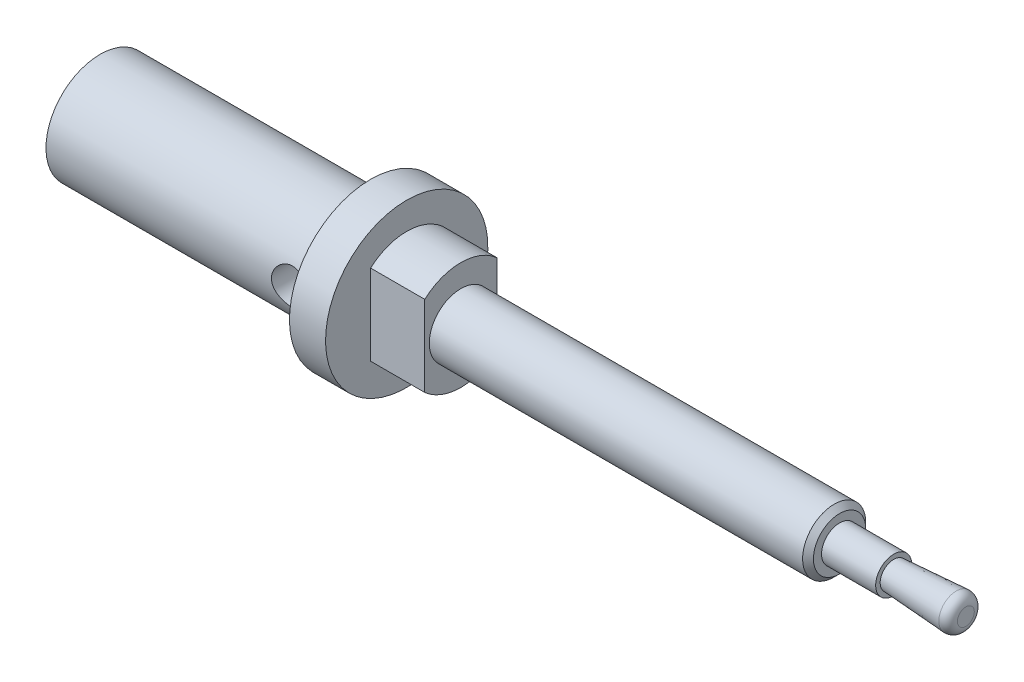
SolidWorks part; units mm, degrees
ref_plane "Plan de face" through (0, 0, 0) normal (0, 0, 1) x (1, 0, 0)
ref_plane "Plan de dessus" through (0, 0, 0) normal (0, 1, 0) x (1, 0, 0)
ref_plane "Plan de droite" through (0, 0, 0) normal (1, 0, 0) x (0, 0, -1)
sketch "Esquisse1" plane through (0, 0, 0) normal (0, 0, 1) x (1, 0, 0)
  line L0 (-15, 0) -> (-15, 3)
  line L1 (-15, 3) -> (0, 3)
  line L2 (0, 3) -> (0, 4.5)
  line L3 (0, 4.5) -> (2, 4.5)
  line L4 (2, 4.5) -> (2, 3)
  line L5 (2, 3) -> (5, 3)
  line L6 (5, 3) -> (5, 1.75)
  line L7 (5, 1.75) -> (26, 1.75)
  line L8 (26, 1.75) -> (26, 1)
  line L9 (26, 1) -> (29, 1)
  line L10 (29, 1) -> (29, 0.75)
  line L11 (33, 1) -> (33, 0)
  line L12 (33, 0) -> (-15, 0)
  line L13 (29, 0.75) -> (33, 1)
  dimension "D1" = 2
  dimension "D2" = 15
  dimension "D3" = 3
  dimension "D4" = 21
  dimension "D5" = 3
  dimension "D6" = 4
  dimension "D7" = 1
  dimension "D8" = 1.75
  dimension "D9" = 1
  dimension "D10" = 3
  dimension "D11" = 3
  dimension "D12" = 4.5
  dimension "D13" = 0.25
revolve "Révolution1" add sketch "Esquisse1" angle 360 about L12
fillet "Congé1" radius 0.5 1 edges at (33, 1, 0)
chamfer "Chanfrein1" distance 0.3 angle 45 1 edges at (26, 1.75, 0)
sketch "Esquisse2" plane through (5, 0, 0) normal (1, 0, 0) x (0, 0, -1)
  line L0 (-2, -2.2361) -> (-2, 2.2361)
  line L1 (2, -2.2361) -> (2, 2.2361)
  circle A0 centre (0, 0) radius 3 construction
  arc A1 (-2, 2.2361) -> (-2, -2.2361) centre (0, 0) ccw
  arc A2 (2, -2.2361) -> (2, 2.2361) centre (0, 0) ccw
  dimension "D1" = 4
  dimension "D2" = 2
extrude "Enlèv. mat.-Extru.1" cut sketch "Esquisse2" against normal up to surface (3 mm away)
hole_wizard "Dégagement M41" positions "Esquisse4" profile "Esquisse3" hole size "M4" standard "ISO"
sketch "Esquisse4" plane through (-15, 0, 0) normal (-1, 0, 0) x (0, 0, 1)
  circle A0 centre (0, 0) radius 3 construction
  point P0 (0, 0)
sketch "Esquisse3" plane through (-15, 0, 0) normal (0, 1, 0) x (0, 0, 1)
  line L0 (0, 0) -> (0, 11.2017)
  line L1 (0, 11.2017) -> (2, 10)
  line L2 (2, 10) -> (2, 0)
  line L5 (2, 0) -> (0, 0)
  line L10 (0, 11.2017) -> (-2, 10) construction
  line L11 (0, -6.35) -> (0, 107.95) construction
  dimension "Diamètre du perçage" = 4
  dimension "Profondeur du perçage" = 10
  dimension "Angle de pointe" = 118
sketch "Esquisse5" plane through (0, 0, 0) normal (0, 0, 1) x (1, 0, 0)
  line L0 (0, 4.5) -> (0, -4.5) construction
  circle A0 centre (-1.5, 0) radius 1
  dimension "D1" = 2
  dimension "D2" = 1.5
extrude "Enlèv. mat.-Extru.2" cut sketch "Esquisse5" against normal through all and the other way through all
